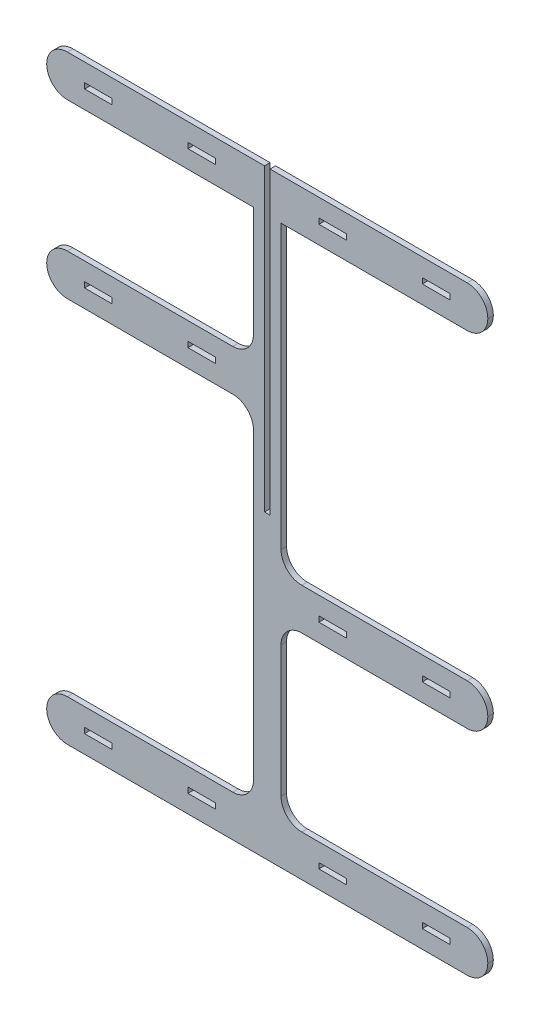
SolidWorks part; units mm, degrees
ref_plane "Alzado" through (0, 0, 0) normal (0, 0, 1) x (1, 0, 0)
ref_plane "Planta" through (0, 0, 0) normal (0, 1, 0) x (1, 0, 0)
ref_plane "Vista lateral" through (0, 0, 0) normal (1, 0, 0) x (0, 0, -1)
sketch "Croquis1" plane through (0, 0, 0) normal (0, 0, 1) x (1, 0, 0)
  line L0 (0, 0) -> (0, 30)
  line L1 (0, 30) -> (320, 30)
  line L2 (320, 30) -> (320, 0)
  line L3 (320, 0) -> (0, 0)
  line L4 (160, 0) -> (160, 30) construction
  line L5 (150, 30) -> (150, 0) construction
  line L6 (0, 15) -> (150, 15) construction
  line L7 (75, 0) -> (75, 30) construction
  line L8 (27.5, 13) -> (47.5, 13)
  line L9 (27.5, 13) -> (27.5, 17)
  line L10 (27.5, 17) -> (47.5, 17)
  line L11 (47.5, 13) -> (47.5, 17)
  line L12 (27.5, 13) -> (47.5, 17) construction
  line L13 (27.5, 17) -> (47.5, 13) construction
  line L14 (102.5, 13) -> (122.5, 13)
  line L15 (102.5, 13) -> (102.5, 17)
  line L16 (102.5, 17) -> (122.5, 17)
  line L17 (122.5, 13) -> (122.5, 17)
  line L18 (102.5, 13) -> (122.5, 17) construction
  line L19 (102.5, 17) -> (122.5, 13) construction
  line L20 (217.5, 17) -> (197.5, 17)
  line L21 (197.5, 13) -> (197.5, 17)
  line L22 (217.5, 13) -> (197.5, 13)
  line L23 (217.5, 13) -> (217.5, 17)
  line L24 (292.5, 17) -> (272.5, 17)
  line L25 (272.5, 13) -> (272.5, 17)
  line L26 (292.5, 13) -> (272.5, 13)
  line L27 (292.5, 13) -> (292.5, 17)
  point P11 (37.5, 15)
  point P16 (112.5, 15)
extrude "Saliente-Extruir1" add sketch "Croquis1" along normal mid plane 4
sketch "Croquis2" plane through (0, 0, 0) normal (0, 0, 1) x (1, 0, 0)
  line L0 (160, 30) -> (160, 435) construction
  line L1 (320, 30) -> (0, 30) construction
  line L2 (170, 30) -> (170, 140)
  line L3 (185, 155) -> (320, 155)
  line L4 (320, 155) -> (320, 185)
  line L5 (320, 185) -> (185, 185)
  line L6 (170, 200) -> (170, 435)
  line L7 (170, 435) -> (150, 435)
  line L8 (150, 435) -> (150, 325)
  line L9 (135, 310) -> (0, 310)
  line L10 (0, 310) -> (0, 280)
  line L11 (0, 280) -> (135, 280)
  line L12 (150, 265) -> (150, 30)
  line L13 (150, 30) -> (170, 30)
  line L14 (0, 295) -> (150, 295) construction
  line L15 (102.5, 293) -> (102.5, 297)
  line L16 (27.5, 293) -> (47.5, 293)
  line L17 (27.5, 293) -> (27.5, 297)
  line L18 (27.5, 297) -> (47.5, 297)
  line L19 (47.5, 293) -> (47.5, 297)
  line L20 (27.5, 293) -> (47.5, 297) construction
  line L21 (27.5, 297) -> (47.5, 293) construction
  line L22 (102.5, 293) -> (122.5, 293)
  line L23 (122.5, 293) -> (122.5, 297)
  line L24 (102.5, 297) -> (122.5, 297)
  line L25 (320, 170) -> (170, 170) construction
  line L27 (272.5, 168) -> (292.5, 168)
  line L28 (272.5, 168) -> (272.5, 172)
  line L29 (272.5, 172) -> (292.5, 172)
  line L30 (292.5, 168) -> (292.5, 172)
  line L31 (272.5, 168) -> (292.5, 172) construction
  line L32 (272.5, 172) -> (292.5, 168) construction
  line L33 (197.5, 168) -> (217.5, 168)
  line L34 (197.5, 168) -> (197.5, 172)
  line L35 (197.5, 172) -> (217.5, 172)
  line L36 (217.5, 168) -> (217.5, 172)
  line L37 (197.5, 168) -> (217.5, 172) construction
  line L38 (197.5, 172) -> (217.5, 168) construction
  arc A0 (135, 280) -> (150, 265) centre (135, 265) cw
  arc A1 (170, 140) -> (185, 155) centre (185, 140) cw
  arc A2 (185, 185) -> (170, 200) centre (185, 200) cw
  arc A3 (150, 325) -> (135, 310) centre (135, 325) cw
  point P21 (37.5, 295)
  point P30 (207.5, 170)
  point P31 (282.5, 170)
  point P41 (150, 280)
  point P44 (170, 155)
  point P47 (170, 185)
extrude "Saliente-Extruir2" add sketch "Croquis2" along normal mid plane 4
fillet "Redondeo1" radius 15 4 edges at (0, 280, 0) (0, 310, 0) (320, 155, 0) (320, 185, 0)
fillet "Redondeo2" radius 15 4 edges at (320, 30, 0) (0, 30, 0) (320, 0, 0) (0, 0, 0)
pattern_linear "MatrizL1" [suppressed] count 1 spacing 280
pattern_linear "MatrizL2" count 2 spacing 405 along (0, 1, 0) of "Saliente-Extruir1", "Redondeo2"
fillet "Redondeo3" radius 15 2 edges at (170, 30, 0) (150, 30, 0)
sketch "Croquis3" plane through (0, 0, 0) normal (0, 0, 1) x (1, 0, 0)
  line L1 (158, 435) -> (162, 435)
  line L2 (158, 435) -> (158, 217.5)
  line L3 (158, 217.5) -> (162, 217.5)
  line L4 (162, 435) -> (162, 217.5)
  line L5 (160, 217.5) -> (160, 0) construction
  line L6 (15, 0) -> (305, 0) construction
extrude "Cortar-Extruir1" cut sketch "Croquis3" against normal through all both and the other way through all
equation "\"totalShelves\" = 1'Numero de estantes"
equation "\"shelfSpacing\"= 25cm'Distancia entre estantes"
equation "\"thickness\"= 4mm'Espesor del material"
equation "\"shelfRadius\"= 15cm'Radio de la repisa "
equation "\"supportWidth\"= 3cm'ancho del soporte"
equation "\"holderWidth\"= 2cm'ancho de la estructura"
equation "\"D1@Croquis1\"=\"supportWidth\""
equation "\"D2@Croquis1\"=\"holderWidth\"/2"
equation "\"D3@Croquis1\"=\"shelfRadius\""
equation "\"D4@Croquis1\"=\"thickness\""
equation "\"tabSlotLength\"= 20mm'Largo de las pestañas "
equation "\"D5@Croquis1\"=\"tabSlotLength\""
equation "\"D6@Croquis1\"=\"shelfRadius\"/2"
equation "\"D7@Croquis1\"=\"shelfRadius\"/4"
equation "\"D1@Saliente-Extruir1\"=\"thickness\""
equation "\"D1@Croquis2\"=\"holderWidth\""
equation "\"D2@Croquis2\"=\"shelfRadius\""
equation "\"D3@Croquis2\"=\"shelfSpacing\""
equation "\"D4@Croquis2\"=\"shelfSpacing\"/2"
equation "\"D5@Croquis2\"=\"supportWidth\""
equation "\"D6@Croquis2\"=\"shelfRadius\"/4"
equation "\"D7@Croquis2\"=\"thickness\""
equation "\"D8@Croquis2\"=\"tabSlotLength\""
equation "\"D10@Croquis2\"=\"shelfRadius\"/2"
equation "\"D11@Croquis2\"=\"shelfRadius\"/2"
equation "\"D12@Croquis2\"=\"shelfRadius\"/4"
equation "\"D3@MatrizL1\"=\"shelfSpacing\"+\"supportWidth\""
equation "\"D1@MatrizL1\"=\"totalShelves\""
equation "\"D3@MatrizL2\"=(\"shelfSpacing\"+\"supportWidth\")*\"totalShelves\"+\"shelfSpacing\"/2"
equation "\"MatrizL1\"= IIF ( \"totalShelves\" > 1 , 0 , 1 )"
equation "\"totalHeight\"= ( \"shelfSpacing\" * \"totalShelves\" ) + ( \"shelfSpacing\" * 0.5 ) + \"supportWidth\" * ( \"totalShelves\" + 1 )'Altura total"
equation "\"D1@Croquis3\"=\"thickness\""
equation "\"D2@Croquis3\"=\"totalHeight\"/2"
equation "\"D3@Croquis3\"=\"totalHeight\""
equation "\"D1@Redondeo1\"=\"supportWidth\"/2"
equation "\"D13@Croquis2\"=\"supportWidth\"/2"
equation "\"D1@Redondeo2\"=\"supportWidth\"/2"
equation "\"D1@Redondeo3\"=\"supportWidth\"/2"
